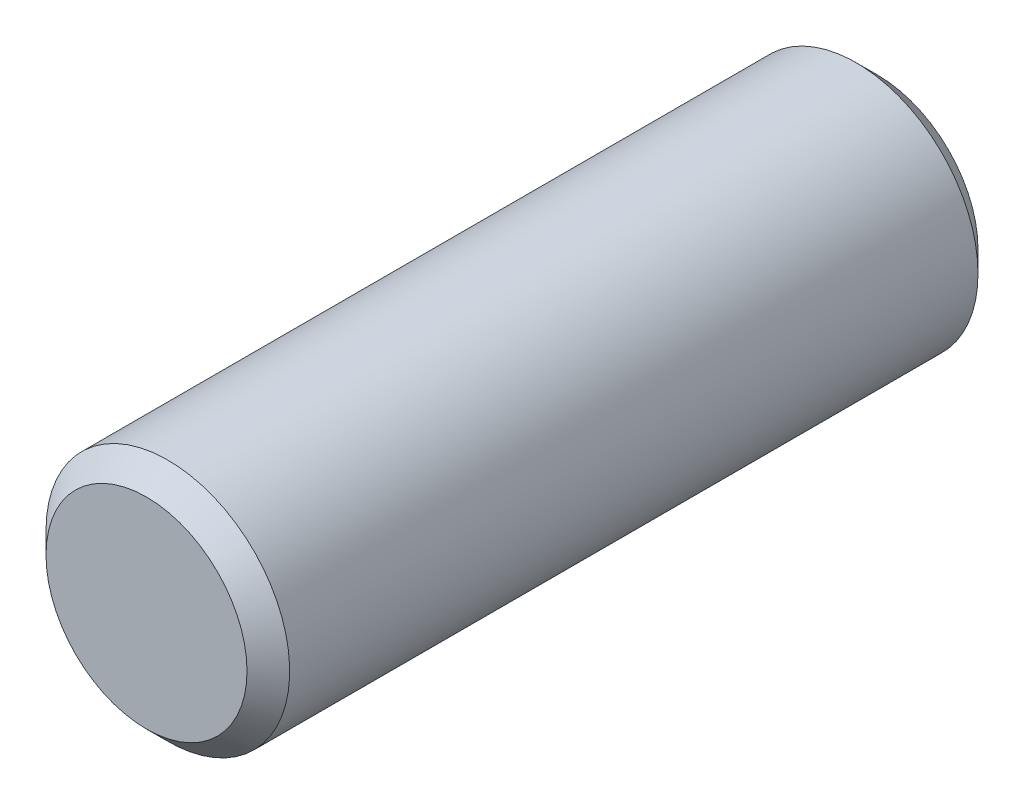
SolidWorks part; units mm, degrees
ref_plane "Спереди" through (0, 0, 0) normal (0, 0, 1) x (1, 0, 0)
ref_plane "Сверху" through (0, 0, 0) normal (0, 1, 0) x (1, 0, 0)
ref_plane "Справа" through (0, 0, 0) normal (1, 0, 0) x (0, 0, -1)
sketch "Эскиз1" plane through (0, 0, 0) normal (0, 0, 1) x (1, 0, 0)
  circle A0 centre (0, 0) radius 2
  dimension "D1" = 4
extrude "Бобышка-Вытянуть1" add sketch "Эскиз1" along normal blind 12
chamfer "Фаска1" distance 0.35 angle 45 2 edges at (2, 0, 0) (2, 0, 12)
